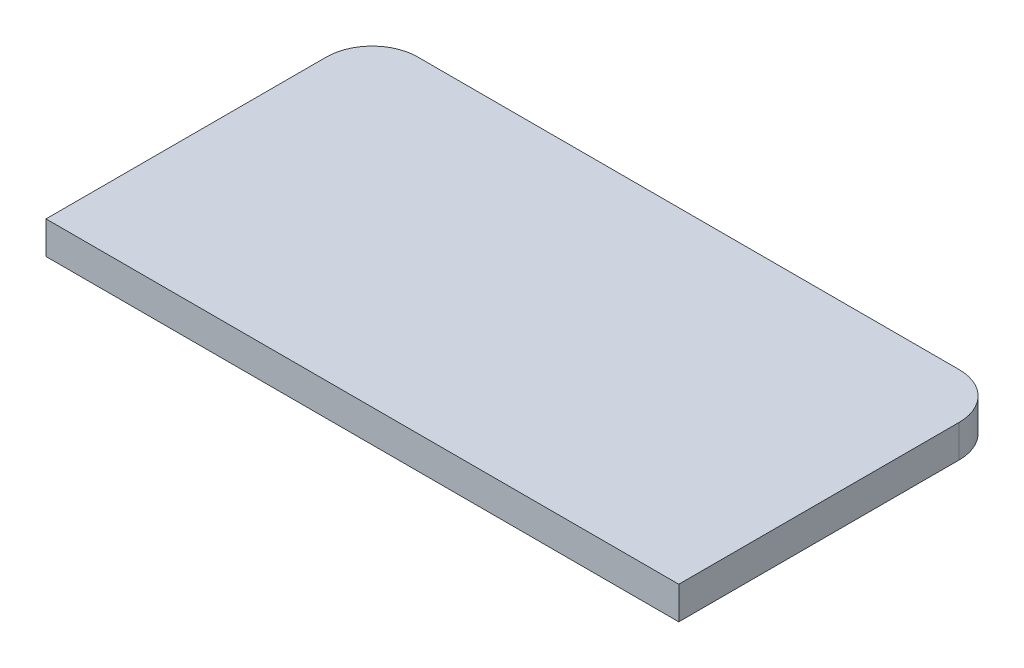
SolidWorks part; units mm, degrees
ref_plane "Front Plane" through (0, 0, 0) normal (0, 0, 1) x (1, 0, 0)
ref_plane "Top Plane" through (0, 0, 0) normal (0, 1, 0) x (1, 0, 0)
ref_plane "Right Plane" through (0, 0, 0) normal (1, 0, 0) x (0, 0, -1)
sketch "Sketch1" plane through (0, 0, 0) normal (0, 1, 0) x (1, 0, 0)
  line L0 (-26.3622, 4.445) -> (26.3622, 4.445)
  line L1 (0, 4.445) -> (0, -27.305) construction
  line L2 (30.8072, -27.305) -> (-30.8072, -27.305)
  line L6 (30.8072, 0) -> (30.8072, -27.305)
  line L7 (-30.8072, 0) -> (-30.8072, -27.305)
  arc A1 (26.3622, 4.445) -> (30.8072, 0) centre (26.3622, 0) cw
  arc A2 (-26.3622, 4.445) -> (-30.8072, 0) centre (-26.3622, 0) ccw
  point P4 (30.8072, 4.445)
  point P10 (-30.8072, 4.445)
  dimension "D1" = 4.445
  dimension "D2" = 52.7244
  dimension "D3" = 31.75
extrude "Boss-Extrude1" add sketch "Sketch1" along normal blind 3.175
